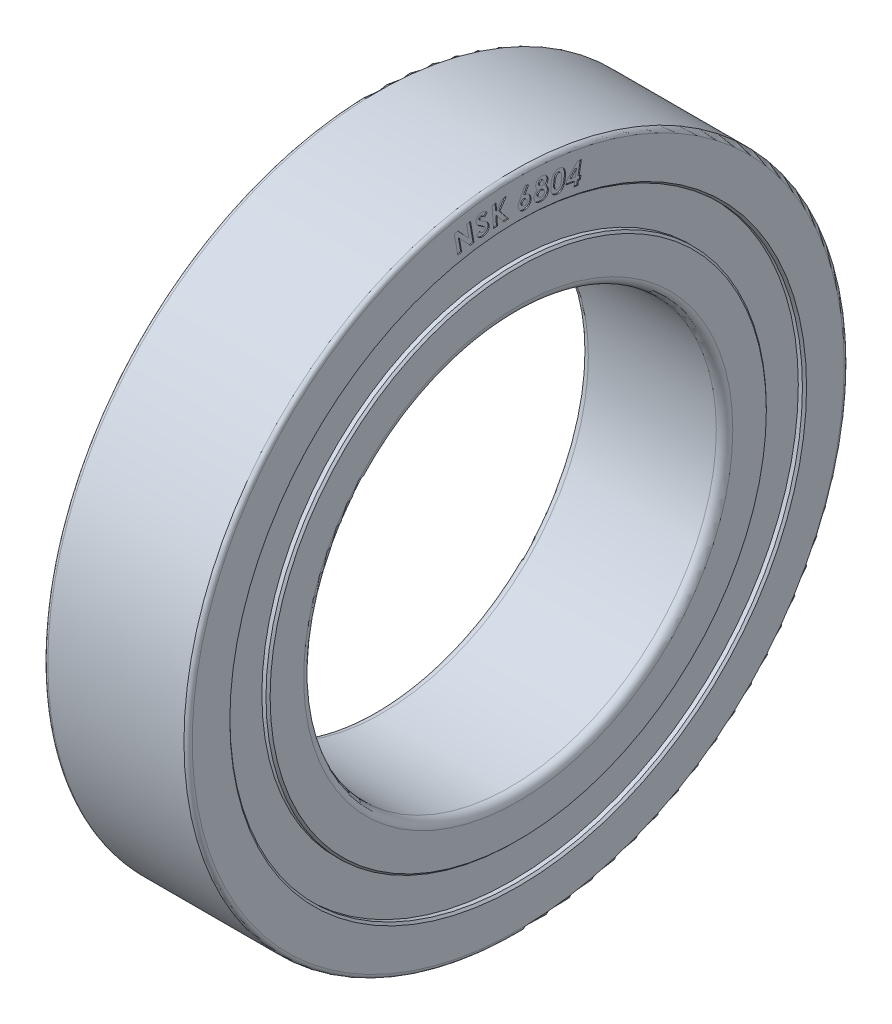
SolidWorks part; units mm, degrees
ref_plane "Front" through (0, 0, 0) normal (0, 0, 1) x (1, 0, 0)
ref_plane "Top" through (0, 0, 0) normal (0, 1, 0) x (1, 0, 0)
ref_plane "Right" through (0, 0, 0) normal (1, 0, 0) x (0, 0, -1)
sketch "Sketch1" plane through (0, 0, 0) normal (0, 0, 1) x (1, 0, 0)
  line L0 (0, 0) -> (-7, 0) construction
  line L1 (-6.9, 13.875) -> (-5.0155, 13.875)
  line L2 (-0.4, 10) -> (-6.6, 10)
  line L3 (0, 10.4) -> (0, 12.025)
  line L4 (-0.2, 16) -> (-6.8, 16)
  line L5 (-7, 10.4) -> (-7, 12.025)
  line L6 (-6.9, 12.125) -> (-5.0155, 12.125)
  line L7 (0, 13.975) -> (0, 15.8)
  line L8 (-1.9845, 13.875) -> (-0.1, 13.875)
  line L9 (-1.9845, 12.125) -> (-0.1, 12.125)
  line L10 (-7, 13.975) -> (-7, 15.8)
  line L11 (-7, 12.025) -> (-6.9, 12.125)
  line L12 (-7, 13.975) -> (-6.9, 13.875)
  line L13 (-0.1, 13.875) -> (0, 13.975)
  line L14 (0, 12.025) -> (-0.1, 12.125)
  arc A0 (-1.9845, 13.875) -> (-5.0155, 13.875) centre (-3.5, 13) ccw
  arc A1 (-5.0155, 12.125) -> (-1.9845, 12.125) centre (-3.5, 13) ccw
  arc A2 (-6.8, 16) -> (-7, 15.8) centre (-6.8, 15.8) ccw
  arc A3 (0, 15.8) -> (-0.2, 16) centre (-0.2, 15.8) ccw
  arc A4 (-6.6, 10) -> (-7, 10.4) centre (-6.6, 10.4) cw
  arc A5 (0, 10.4) -> (-0.4, 10) centre (-0.4, 10.4) cw
  point P10 (0, 12.125)
  point P13 (0, 13.875)
  point P16 (-7, 12.125)
  point P17 (-7, 13.875)
  point P18 (-7, 16)
  point P21 (0, 16)
  point P24 (-7, 10)
  dimension "D4" = 3.5
  dimension "D12" = 0.2
  dimension "D13" = 0.4
  dimension "D1" = 10
  dimension "D2" = 16
  dimension "D3" = 7
  dimension "D5" = 6
  dimension "D6" = 3
  dimension "D7" = 3.5
  dimension "D8" = 13
  dimension "D9" = 2.125
  dimension "D10" = 2.125
revolve "Revolve1" add sketch "Sketch1" angle 360 about L0
sketch "Sketch2" plane through (0, 0, 0) normal (0, 0, 1) x (1, 0, 0)
  line L0 (-3.5, 14.75) -> (-3.5, 11.25)
  arc A0 (-3.5, 11.25) -> (-3.5, 14.75) centre (-3.5, 13) ccw
  dimension "D1" = 3.5
  dimension "D2" = 13
  dimension "D3" = 3.5
revolve "Revolve2" add sketch "Sketch2" angle 360 about L0
pattern_circular "CirPattern1" count 12 over 360 about axis through (0, 0, 0) along (1, 0, 0)
sketch "Sketch5" plane through (0, 0, 0) normal (1, 0, 0) x (0, 0, -1)
  line L0 (0, 0) -> (0, 14.3) construction
  line L1 (0, 0) -> (-7.15, 12.3842) construction
  line L2 (0, 0) -> (7.15, 12.3842) construction
  arc A0 (7.15, 12.3842) -> (-7.15, 12.3842) centre (0, 0) ccw construction
  text T0 "NSK 6804" font "Century Gothic" height 1
  dimension "D2" = 14.3
  dimension "D1" = 30
wrap "Wrap1" sketch "Sketch5" wrap type deboss source sketch "Sketch5" thickness 0.05 parameters "D1"=0.05
ref_plane "Plane1" through (-0.5, 0, 0) normal (1, 0, 0) x (0, 0, -1)
sketch "Sketch3" plane through (-0.5, 0, 0) normal (1, 0, 0) x (0, 0, -1)
  circle A0 centre (0, 0) radius 12.125
  circle A1 centre (0, 0) radius 13.875
  dimension "D1" = 27.75
  dimension "D2" = 24.25
extrude "Seal 1" add sketch "Sketch3" along normal blind 0.2
ref_plane "Plane2" through (-6.5, 0, 0) normal (-1, 0, 0) x (0, 0, 1)
sketch "Sketch4" plane through (-6.5, 0, 0) normal (-1, 0, 0) x (0, 0, 1)
  circle A0 centre (0, 0) radius 12.125
  circle A1 centre (0, 0) radius 13.875
  dimension "D1" = 24.25
  dimension "D2" = 27.75
extrude "Seal 2" add sketch "Sketch4" along normal blind 0.2
